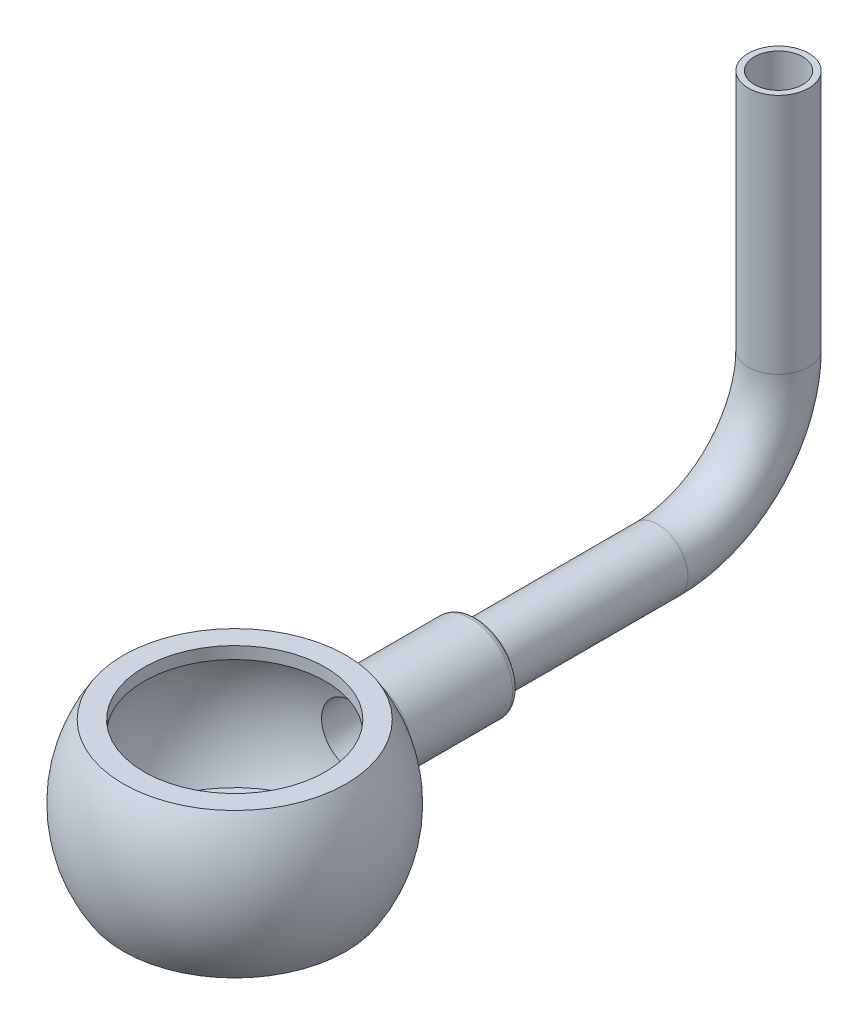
SolidWorks part; units mm, degrees
ref_plane "Front" through (0, 0, 0) normal (0, 0, 1) x (1, 0, 0)
ref_plane "Top" through (0, 0, 0) normal (0, 1, 0) x (1, 0, 0)
ref_plane "Right" through (0, 0, 0) normal (1, 0, 0) x (0, 0, -1)
sketch "Sketch2" plane through (0, 0, 0) normal (1, 0, 0) x (0, 0, -1)
  line L0 (0, 6) -> (0, -6) construction
  line L1 (0, 6) -> (9.2195, 6)
  line L2 (0, -6) -> (9.2195, -6)
  line L3 (0, 0) -> (0, -7.0534) construction
  line L4 (0, 0) -> (-2.7451, 0) construction
  line L5 (11, 0) -> (11, -4.5077) construction
  line L6 (0, 5) -> (8.6603, 5)
  line L7 (0, -5) -> (8.6603, -5)
  line L8 (0, 6) -> (0, 5)
  line L9 (0, -5) -> (0, -6)
  arc A0 (9.2195, -6) -> (9.2195, 6) centre (0, 0) ccw
  arc A1 (8.6603, -5) -> (8.6603, 5) centre (0, 0) ccw
  dimension "D1" = 22
  dimension "D2" = 12
  dimension "D3" = 1
revolve "Revolve1" add sketch "Sketch2" angle 360 about L3
sketch "Sketch3" plane through (0, 0, 0) normal (0, 1, 0) x (1, 0, 0)
  circle A0 centre (0, 0) radius 7.5
  dimension "D1" = 15
extrude "Cut-Extrude1" cut sketch "Sketch3" against normal through all and the other way through all
ref_plane "Plane1" through (0, 0, -20) normal (0, 0, 1) x (1, 0, 0)
sketch "Sketch4" plane through (0, 0, -20) normal (0, 0, 1) x (1, 0, 0)
  circle A0 centre (0, 0) radius 3.5
  dimension "D1" = 7
extrude "Boss-Extrude1" add sketch "Sketch4" along normal up to next
sketch "Sketch5" plane through (0, 0, -20) normal (0, 0, -1) x (-1, 0, 0)
  circle A0 centre (0, 0) radius 2.5
  dimension "D1" = 5
extrude "Cut-Extrude2" cut sketch "Sketch5" against normal up to next
fillet "Fillet1" radius 1 1 edges at (3.5, 0, -10.4283)
sketch "Sketch6" plane through (0, 0, 0) normal (1, 0, 0) x (0, 0, -1)
  line L0 (20, 0) -> (35, 0)
  line L1 (20, 11) -> (20, -11) construction
  line L2 (45, 10) -> (45, 30)
  arc A0 (35, 0) -> (45, 10) centre (35, 10) ccw
  dimension "D2" = 10
  dimension "D1" = 25
  dimension "D3" = 30
sketch "Sketch7" plane through (0, 0, -20) normal (0, 0, 1) x (1, 0, 0)
  circle A0 centre (0, 0) radius 2.5 construction
  circle A1 centre (0, 0) radius 2
  circle A3 centre (0, 0) radius 2.5
  dimension "D1" = 0.5
sweep "Sweep1" add profiles "Sketch7" path "Sketch6"
sketch "Sketch8" plane through (0, 0, -20) normal (0, 0, 1) x (1, 0, 0)
  circle A0 centre (0, 0) radius 2 construction
  circle A1 centre (0, 0) radius 2.5
  circle A2 centre (0, 0) radius 2.5
  circle A3 centre (0, 0) radius 2
  dimension "D1" = 0
extrude "Boss-Extrude2" add sketch "Sketch8" along normal blind 5
fillet "Fillet2" radius 0.5 2 edges at (3.5, 0, -20) (2.5, 0, -20)
